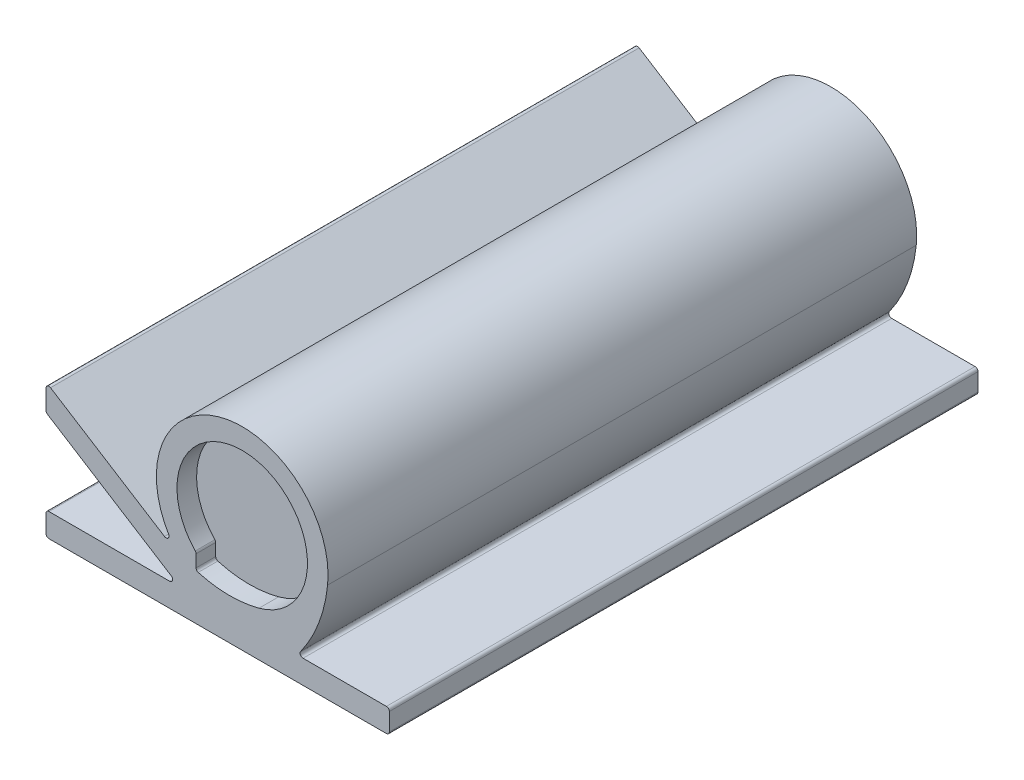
SolidWorks part; units mm, degrees
ref_plane "Alzado" through (0, 0, 0) normal (0, 0, 1) x (1, 0, 0)
ref_plane "Planta" through (0, 0, 0) normal (0, 1, 0) x (1, 0, 0)
ref_plane "Vista lateral" through (0, 0, 0) normal (1, 0, 0) x (0, 0, -1)
sketch "Sketch1" plane through (0, 0, 0) normal (0, 0, 1) x (1, 0, 0)
  line L0 (-20, 0) -> (15, 0)
  line L1 (15, 0) -> (15, 2.4)
  line L2 (15, 2.4) -> (5.6, 2.4)
  line L3 (-20, 0) -> (-20, 2.4)
  line L4 (-20, 2.4) -> (-6.35, 2.4)
  line L5 (-6.35, 2.4) -> (-20, 11)
  line L6 (-20, 11) -> (-20, 13.7)
  line L7 (-20, 13.7) -> (-6.6044, 5.2603)
  arc A1 (8.7042, 10.106) -> (-6.6044, 5.2603) centre (0, 11) ccw
  arc A6 (5.6, 2.4) -> (8.7042, 10.106) centre (-6.2173, 11.6386) ccw
  point P21 (-20, 1.2)
  dimension "D1" = 17.5
  dimension "D2" = 13.7
  dimension "D17" = 15
  dimension "D3" = 20
  dimension "D4" = 2.4
  dimension "D5" = 2.4
  dimension "D6" = 2.7
  dimension "D7" = 20
  dimension "D8" = 6.35
  dimension "D9" = 5.6
  dimension "D10" = 15
  dimension "D11" = 11
extrude "Boss-Extrude1" add sketch "Sketch1" along normal blind 60
sketch "Sketch2" plane through (0, 0, 60) normal (0, 0, 1) x (1, 0, 0)
  line L0 (-4.7, 6.2955) -> (-4.7, 4.7)
  arc A1 (-4.7, 4.7) -> (1.7132, 4.5745) centre (-1.2752, 15.7829) ccw
  arc A3 (1.7132, 4.5745) -> (-4.7, 6.2955) centre (0, 11) ccw
  dimension "D1" = 6.65
  dimension "D4" = 11.6
  dimension "D2" = 1.5955
  dimension "D3" = 4.7
extrude "Cut-Extrude1" cut sketch "Sketch2" against normal blind 2
fillet "Fillet1" radius 0.3 11 edges at (-4.7, 4.7, 59) (-6.6044, 5.2603, 30) (-6.35, 2.4, 30) (5.6, 2.4, 30) (15, 0, 30) (15, 2.4, 30) (-4.7, 6.2955, 59) (-20, 11, 30) (-20, 13.7, 30) (-20, 0, 30) (-20, 2.4, 30)
